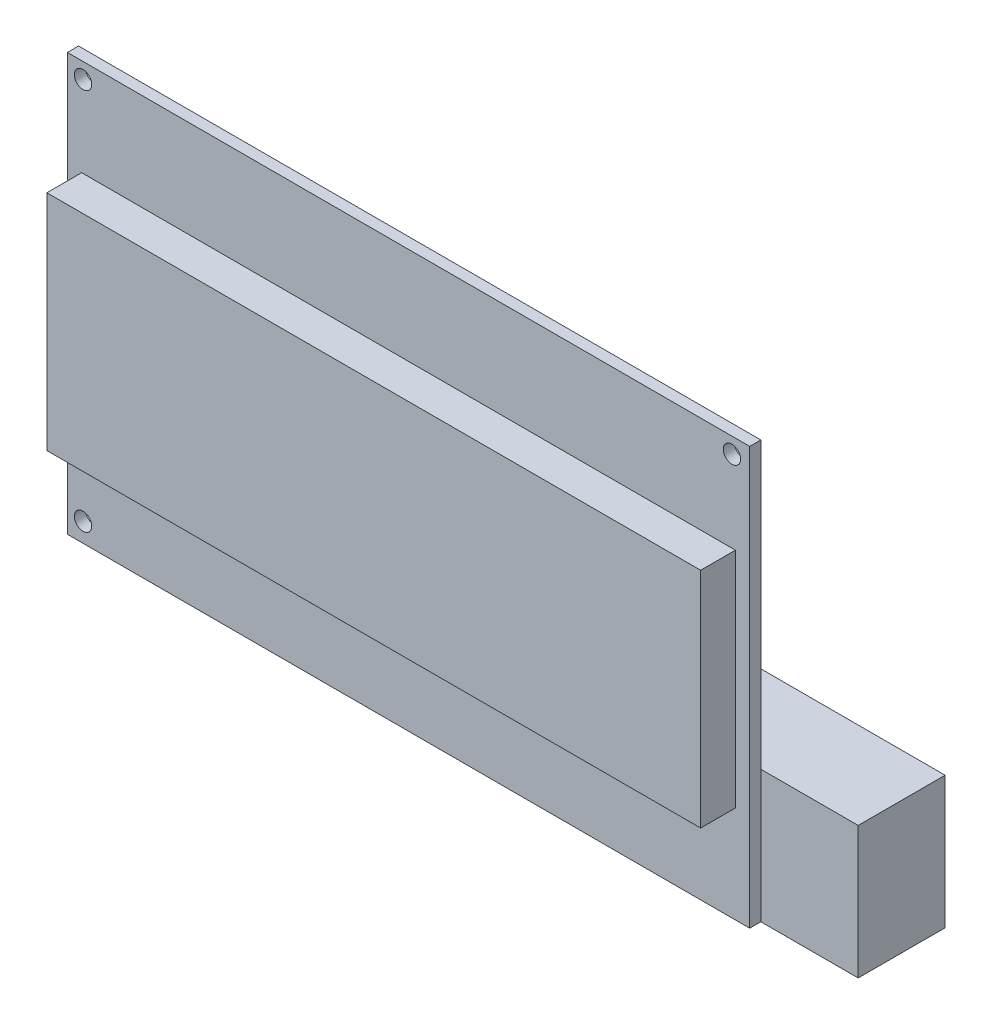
SolidWorks part; units mm, degrees
ref_plane "Plan de face" through (0, 0, 0) normal (0, 0, 1) x (1, 0, 0)
ref_plane "Plan de dessus" through (0, 0, 0) normal (0, 1, 0) x (1, 0, 0)
ref_plane "Plan de droite" through (0, 0, 0) normal (1, 0, 0) x (0, 0, -1)
sketch "Esquisse1" plane through (0, 0, 0) normal (0, 0, 1) x (1, 0, 0)
  line L1 (0, 0) -> (98.1, 0)
  line L2 (0, 0) -> (0, 60)
  line L3 (0, 60) -> (98.1, 60)
  line L4 (98.1, 0) -> (98.1, 60)
  dimension "D1" = 98.1
  dimension "D2" = 60
extrude "Boss.-Extru.1" add sketch "Esquisse1" along normal blind 1.6
sketch "Esquisse2" plane through (0, 0, 1.6) normal (0, 0, 1) x (1, 0, 0)
  line L0 (98.1, 0) -> (98.1, 60) construction
  line L1 (2.05, 46.05) -> (96.05, 46.05)
  line L2 (2.05, 46.05) -> (2.05, 13.95)
  line L3 (2.05, 13.95) -> (96.05, 13.95)
  line L4 (96.05, 46.05) -> (96.05, 13.95)
  line L5 (0, 0) -> (98.1, 0) construction
  dimension "D1" = 32.1
  dimension "D2" = 94
  dimension "D3" = 2.05
  dimension "D4" = 13.95
extrude "Boss.-Extru.2" add sketch "Esquisse2" along normal blind 5
sketch "Esquisse3" plane through (0, 0, 0) normal (0, 0, -1) x (-1, 0, 0)
  line L0 (0, 0) -> (-98.1, 0) construction
  line L1 (-112.1, 19) -> (-54.1, 19)
  line L2 (-112.1, 19) -> (-112.1, 0)
  line L3 (-112.1, 0) -> (-54.1, 0)
  line L4 (-54.1, 19) -> (-54.1, 0)
  line L5 (-98.1, 0) -> (-98.1, 60) construction
  dimension "D1" = 19
  dimension "D2" = 58
  dimension "D3" = 14
extrude "Boss.-Extru.3" add sketch "Esquisse3" along normal blind 12.5
sketch "Esquisse4" plane through (0, 0, 0) normal (0, 0, -1) x (-1, 0, 0)
  line L0 (-98.1, 60) -> (0, 60) construction
  line L4 (0, 60) -> (0, 0) construction
  circle A0 centre (-2.25, 57.75) radius 1.25
  circle A1 centre (-95.55, 57.75) radius 1.25
  circle A2 centre (-2.25, 2.75) radius 1.25
  dimension "D1" = 2.5
  dimension "D2" = 2.5
  dimension "D3" = 2.25
  dimension "D4" = 2.25
  dimension "D5" = 93.3
  dimension "D6" = 55
  dimension "D7" = 2.5
extrude "Enlèv. mat.-Extru.1" cut sketch "Esquisse4" against normal up to next
sketch "Esquisse5" plane through (54.1, 0, 0) normal (-1, 0, 0) x (0, 0, 1)
  line L0 (-12.5, 0) -> (-12.5, 19) construction
  line L1 (-7.5, 12.8943) -> (-5.5, 12.8943)
  line L2 (-7.5, 12.8943) -> (-7.5, 4.8943)
  line L3 (-7.5, 4.8943) -> (-5.5, 4.8943)
  line L4 (-5.5, 12.8943) -> (-5.5, 4.8943)
  dimension "D1" = 2
  dimension "D2" = 8
  dimension "D3" = 5
extrude "Boss.-Extru.4" add sketch "Esquisse5" along normal blind 6
